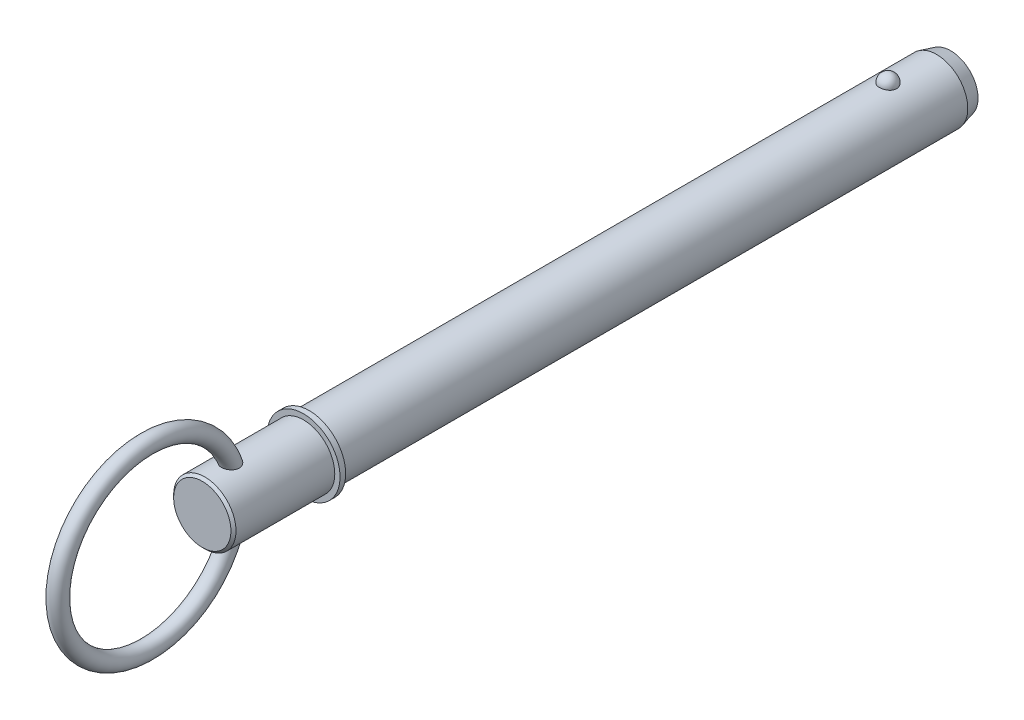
SolidWorks part; units mm, degrees
ref_plane "Front Plane" through (0, 0, 0) normal (0, 0, 1) x (1, 0, 0)
ref_plane "Top Plane" through (0, 0, 0) normal (0, 1, 0) x (1, 0, 0)
ref_plane "Right Plane" through (0, 0, 0) normal (1, 0, 0) x (0, 0, -1)
sketch "Sketch2" plane through (0, 0, 0) normal (0, 0, 1) x (1, 0, 0)
  circle A0 centre (0, 0) radius 11.115
  point P3 (0, 11.115)
  dimension "D1" = 22.23
extrude "Boss-Extrude1" add sketch "Sketch2" along normal blind 203.2
sketch "Sketch3" plane through (0, 0, 0) normal (0, 0, -1) x (-1, 0, 0)
  circle A0 centre (0, 0) radius 11.115
  dimension "D1" = 22.23
extrude "Boss-Extrude2" add sketch "Sketch3" along normal blind 25.4
chamfer "Chamfer1" distance 5 angle 15 1 edges at (-11.115, 0, -25.4)
sketch "Sketch18" plane through (0, 0, 0) normal (1, 0, 0) x (0, 0, -1)
  line L0 (20.4, 11.115) -> (-203.2, 11.115) construction
  line L1 (3.07, 14.185) -> (3.07, 8.045)
  line L2 (-203.2, -11.115) -> (20.4, -11.115) construction
  arc A0 (3.07, 14.185) -> (3.07, 8.045) centre (3.07, 11.115) ccw
  point P4 (0, 11.115)
  dimension "D1" = 25.3
revolve "Revolve1" add sketch "Sketch18" angle 360 about L1
sketch "Sketch19" plane through (0, 0, 0) normal (1, 0, 0) x (0, 0, -1)
  line L0 (-33.7288, 0) -> (-46.4542, 0) construction
sketch "Sketch20" plane through (0, 0, 0) normal (1, 0, 0) x (0, 0, -1)
  line L0 (-203.2, 0) -> (-203.2, 13)
  line L1 (-203.2, 11.115) -> (-203.2, -11.115) construction
  line L2 (-203.2, 13) -> (-205.2, 13)
  line L3 (-205.2, 13) -> (-205.2, 0)
  line L4 (-33.7288, 0) -> (-46.4542, 0) construction
  line L5 (-205.2, 0) -> (-203.2, 0)
  dimension "D1" = 13
  dimension "D2" = 2
revolve "Revolve2" add sketch "Sketch20" angle 360 about L0
sketch "Sketch21" plane through (0, 0, 203.2) normal (0, 0, -1) x (-1, 0, 0)
  circle A0 centre (0, 0) radius 11.115
  dimension "D1" = 22.23
extrude "Boss-Extrude3" add sketch "Sketch21" against normal blind 38.1
chamfer "Chamfer2" distance 0.9 angle 45 1 edges at (-11.115, 0, 241.3)
sketch "Sketch23" plane through (0, 0, 0) normal (1, 0, 0) x (0, 0, -1)
  line L0 (-241.3, 10.215) -> (-241.3, -10.215) construction
  circle A0 centre (-261.05, 0) radius 31.75
  point P2 (-229.3, 0)
  dimension "D1" = 63.5
  dimension "D2" = 12
sketch "Sketch24" plane through (0, 0, 0) normal (0, 1, 0) x (1, 0, 0)
  circle A0 centre (0, -229.3) radius 3
  dimension "D1" = 6
sweep "Sweep1" add profiles "Sketch24" path "Sketch23"
